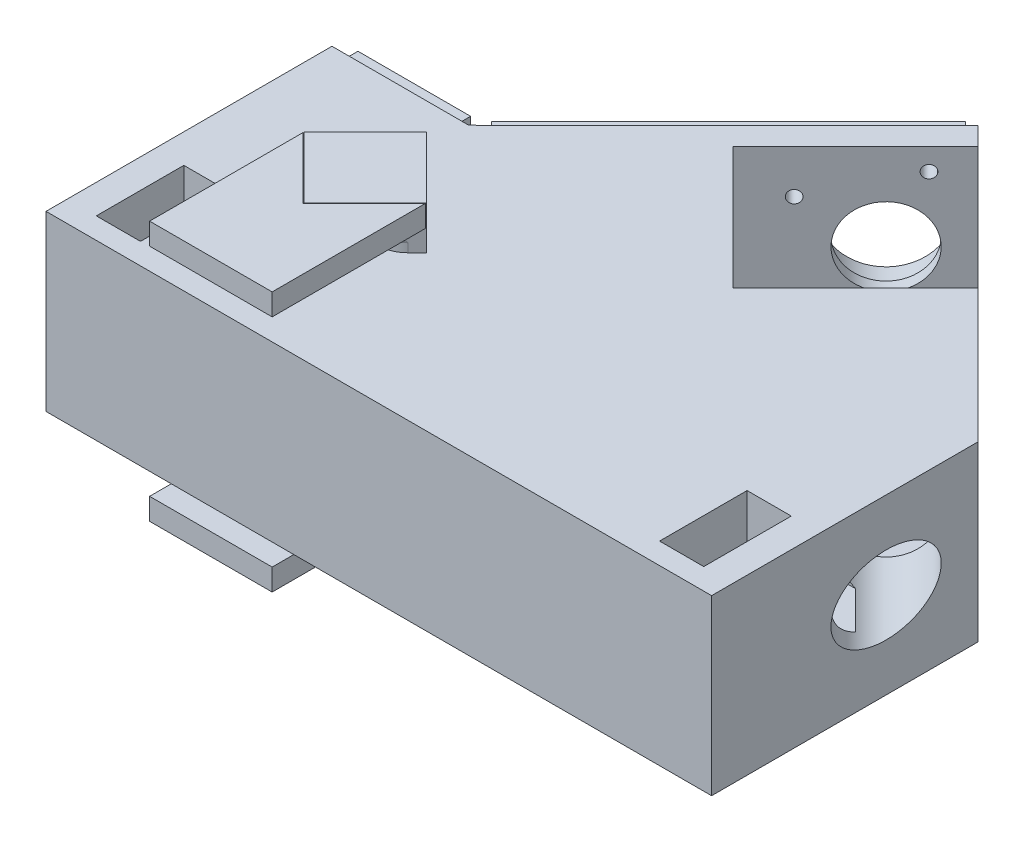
SolidWorks part; units mm, degrees
ref_plane "Спереди" through (0, 0, 0) normal (0, 0, 1) x (1, 0, 0)
ref_plane "Сверху" through (0, 0, 0) normal (0, 1, 0) x (1, 0, 0)
ref_plane "Справа" through (0, 0, 0) normal (1, 0, 0) x (0, 0, -1)
sketch "Sketch1" plane through (0, 0, 0) normal (0, 1, 0) x (1, 0, 0)
  line L0 (-79.5035, -54.4347) -> (-79.5035, -4.4347)
  line L1 (-79.5035, -54.4347) -> (60.4965, -54.4347)
  line L2 (-21.9513, 53.1175) -> (-14.8802, 46.0465)
  line L3 (-21.9513, 53.1175) -> (-46.7, 28.3688)
  line L4 (-14.8802, 46.0465) -> (-43.1645, 17.7622)
  line L5 (-43.1645, 17.7622) -> (-14.8802, -10.5221)
  line L6 (-14.8802, -10.5221) -> (13.404, 17.7622)
  line L7 (13.404, 17.7622) -> (60.4965, -29.3302)
  line L8 (60.4965, -29.3302) -> (60.4965, -54.4347)
  line L9 (-79.5035, -4.4347) -> (-46.7, 28.3688)
  dimension "D1" = 35
  dimension "D2" = 140
  dimension "D3" = 40
  dimension "D4" = 50
  dimension "D5" = 10
  dimension "D6" = 40
extrude "Boss-Extrude1" add sketch "Sketch1" along normal blind 40
sketch "Sketch3" plane through (-37.5344, 0, -37.5344) normal (-0.7071, 0, -0.7071) x (-0.7071, 0, 0.7071)
  line L0 (-22.0379, 20) -> (59.3533, 20) construction
  line L1 (-22.0379, 40) -> (-22.0379, 0) construction
  line L2 (59.3533, 40) -> (59.3533, 0) construction
  circle A0 centre (-7.0379, 20) radius 9
  dimension "D1" = 18
  dimension "D2" = 15
extrude "Cut-Extrude1" cut sketch "Sketch3" against normal through all
sketch "Sketch4" plane through (15.5831, 0, -15.5831) normal (0.7071, 0, -0.7071) x (-0.7071, 0, -0.7071)
  line L0 (3.0817, 20) -> (-63.517, 20) construction
  line L1 (3.0817, 40) -> (3.0817, 0) construction
  line L2 (-63.517, 40) -> (-63.517, 0) construction
  line L3 (-6.9183, 0) -> (-6.9183, 40) construction
  line L4 (-63.517, 0) -> (3.0817, 0) construction
  line L5 (-63.517, 40) -> (3.0817, 40) construction
  line L6 (-31.9183, 0) -> (-31.9183, 40) construction
  line L7 (-6.9183, 5) -> (-6.9183, 35)
  line L8 (-6.9183, 35) -> (-31.9183, 35)
  line L9 (-31.9183, 35) -> (-31.9183, 5)
  line L10 (-31.9183, 5) -> (-6.9183, 5)
  dimension "D1" = 10
  dimension "D2" = 25
  dimension "D3" = 5
  dimension "D4" = 5
extrude "Cut-Extrude2" cut sketch "Sketch4" against normal blind 30
sketch "Sketch5" plane through (-37.5344, 0, -37.5344) normal (-0.7071, 0, -0.7071) x (-0.7071, 0, 0.7071)
  circle A0 centre (-7.0379, 20) radius 11.1
  dimension "D1" = 22.2
extrude "Cut-Extrude3" cut sketch "Sketch5" against normal blind 7
sketch "Sketch6" plane through (4.892, 0, 4.892) normal (0.7071, 0, 0.7071) x (0.7071, 0, -0.7071)
  circle A0 centre (7.0379, 20) radius 11.1
  dimension "D1" = 22.2
extrude "Cut-Extrude4" cut sketch "Sketch6" against normal blind 7
sketch "Sketch7" plane through (0, 40, 0) normal (0, 1, 0) x (1, 0, 0)
  line L0 (44.1167, -12.9505) -> (44.1167, -54.4347)
  line L1 (60.4965, -29.3302) -> (13.404, 17.7622) construction
  line L2 (-79.5035, -54.4347) -> (60.4965, -54.4347) construction
  line L3 (44.1167, -54.4347) -> (60.4965, -54.4347)
  line L4 (60.4965, -54.4347) -> (60.4965, -29.3302)
  line L5 (60.4965, -29.3302) -> (44.1167, -12.9505)
extrude "Cut-Extrude5" cut sketch "Sketch7" against normal through all
sketch "Sketch9" plane through (-79.5035, 0, 0) normal (-1, 0, 0) x (0, 0, 1)
  line L0 (4.4347, 0) -> (54.4347, 0)
  line L1 (54.4347, 0) -> (54.4347, 40)
  line L2 (54.4347, 40) -> (4.4347, 40)
  line L3 (4.4347, 40) -> (4.4347, 0)
extrude "Boss-Extrude2" add sketch "Sketch9" along normal blind 30
sketch "Sketch11" plane through (-37.5344, 0, -37.5344) normal (-0.7071, 0, -0.7071) x (-0.7071, 0, 0.7071)
  line L0 (7.9621, 0) -> (7.9621, 40) construction
  line L1 (-22.0379, 0) -> (59.3533, 0) construction
  line L2 (-22.0379, 40) -> (59.3533, 40) construction
  circle A1 centre (7.9621, 10) radius 1.45
  circle A2 centre (7.9621, 30) radius 1.45
  circle A3 centre (-7.0379, 20) radius 11.1 construction
  point P10 (7.9621, 20)
  dimension "D1" = 20
  dimension "D4" = 2.9
  dimension "D2" = 10
  dimension "D3" = 15
extrude "Cut-Extrude8" cut sketch "Sketch11" against normal blind 20
sketch "Sketch13" plane through (0, 40, 0) normal (0, 1, 0) x (1, 0, 0)
  line L0 (-21.9513, 53.1175) -> (-57.0321, 88.7453) construction
  line L1 (-109.5035, -4.4347) -> (-109.5035, 36.2739) construction
  line L2 (-109.5035, 36.2739) -> (-57.0321, 88.7453) construction
  line L3 (-21.9513, 53.1175) -> (-79.5035, -4.4347) construction
  line L4 (-109.5035, -4.4347) -> (-79.5035, -4.4347) construction
  line L5 (-79.5035, -4.4347) -> (-21.9513, 53.1175) construction
  dimension "D1" = 50
  dimension "D2" = 74.2058
  dimension "D3" = 40.7086
  dimension "D4" = 135
  dimension "D5" = 30
  dimension "D6" = 81.3912
sketch "Sketch15" plane through (-37.5344, 0, -37.5344) normal (-0.7071, 0, -0.7071) x (-0.7071, 0, 0.7071)
  line L0 (-22.0379, 0) -> (59.3533, 40) construction
  line L1 (-22.0379, 40) -> (-22.0379, 0) construction
  line L2 (57.3533, 38) -> (-20.0379, 38)
  line L3 (57.3533, 38) -> (57.3533, 2)
  line L4 (57.3533, 2) -> (-20.0379, 2)
  line L5 (-20.0379, 38) -> (-20.0379, 2)
  line L6 (57.3533, 38) -> (-20.0379, 2) construction
  line L7 (57.3533, 2) -> (-20.0379, 38) construction
  line L8 (-22.0379, 0) -> (59.3533, 0) construction
  line L10 (59.3533, 40) -> (-22.0379, 40)
  line L11 (59.3533, 40) -> (59.3533, 0)
  line L12 (59.3533, 0) -> (-22.0379, 0)
  line L13 (-22.0379, 40) -> (-22.0379, 0)
  line L14 (59.3533, 40) -> (-22.0379, 0) construction
  line L15 (59.3533, 0) -> (-22.0379, 40) construction
  point P4 (18.6577, 20)
  point P13 (18.6577, 20)
  dimension "D1" = 2
  dimension "D2" = 2
extrude "Cut-Extrude9" cut sketch "Sketch15" against normal blind 4
sketch "Sketch16" plane through (0, 0, 4.4347) normal (0, 0, -1) x (-1, 0, 0)
  line L0 (79.5035, 0) -> (109.5035, 40) construction
  line L2 (109.5035, 40) -> (79.5035, 40)
  line L3 (109.5035, 40) -> (109.5035, 0)
  line L4 (109.5035, 0) -> (79.5035, 0)
  line L5 (79.5035, 40) -> (79.5035, 0)
  line L6 (109.5035, 40) -> (79.5035, 0) construction
  line L7 (109.5035, 0) -> (79.5035, 40) construction
  line L8 (107.5035, 38) -> (81.5035, 38)
  line L9 (107.5035, 38) -> (107.5035, 2)
  line L10 (107.5035, 2) -> (81.5035, 2)
  line L11 (81.5035, 38) -> (81.5035, 2)
  line L12 (107.5035, 38) -> (81.5035, 2) construction
  line L13 (107.5035, 2) -> (81.5035, 38) construction
  point P4 (94.5035, 20)
  point P5 (94.5035, 20)
  dimension "D1" = 2
  dimension "D2" = 2
extrude "Cut-Extrude10" cut sketch "Sketch16" against normal blind 4
sketch "Sketch17" plane through (0, 0, 0) normal (0, -1, 0) x (1, 0, 0)
  line L0 (-76.6751, 7.2631) -> (-78.0893, 8.4347)
  line L1 (-78.0893, 8.4347) -> (-79.5035, 8.4347)
  line L2 (-79.5035, 8.4347) -> (-109.5035, 8.4347) construction
  line L3 (-76.6751, 7.2631) -> (-79.5035, 4.4347)
  line L4 (-79.5035, 4.4347) -> (-79.5035, 8.4347)
extrude "Cut-Extrude11" cut sketch "Sketch17" against normal through all
sketch "Sketch18" plane through (0, 40, 0) normal (0, 1, 0) x (1, 0, 0)
  line L0 (-109.5035, -54.4347) -> (-109.5035, -74.4347)
  line L1 (-109.5035, -74.4347) -> (44.1167, -74.4347)
  line L2 (44.1167, -74.4347) -> (44.1167, -54.4347)
  line L3 (44.1167, -54.4347) -> (-109.5035, -54.4347)
  dimension "D1" = 20
extrude "Boss-Extrude3" add sketch "Sketch18" against normal up to surface (40 mm away)
sketch "Sketch10" plane through (0, 40, 0) normal (0, 1, 0) x (1, 0, 0)
  line L0 (-109.5035, -59.4347) -> (44.1167, -59.4347) construction
  line L1 (-109.5035, -74.4347) -> (-109.5035, -8.4347) construction
  line L2 (44.1167, -12.9505) -> (44.1167, -74.4347) construction
  line L4 (-102.7934, -69.5347) -> (-92.5934, -69.5347)
  line L5 (-102.7934, -69.5347) -> (-102.7934, -49.3347)
  line L6 (-102.7934, -49.3347) -> (-92.5934, -49.3347)
  line L7 (-92.5934, -69.5347) -> (-92.5934, -49.3347)
  line L8 (-102.7934, -69.5347) -> (-92.5934, -49.3347) construction
  line L9 (-102.7934, -49.3347) -> (-92.5934, -69.5347) construction
  line L10 (37.4066, -69.5347) -> (27.2066, -69.5347)
  line L11 (37.4066, -69.5347) -> (37.4066, -49.3347)
  line L12 (37.4066, -49.3347) -> (27.2066, -49.3347)
  line L13 (27.2066, -69.5347) -> (27.2066, -49.3347)
  line L14 (37.4066, -69.5347) -> (27.2066, -49.3347) construction
  line L15 (37.4066, -49.3347) -> (27.2066, -69.5347) construction
  point P6 (-97.6934, -59.4347)
  point P11 (32.3066, -59.4347)
  point P18 (-32.6934, -59.4347)
  dimension "D1" = 10.2
  dimension "D2" = 20.2
  dimension "D3" = 15
  dimension "D4" = 130
  dimension "D5" = 65
  dimension "D6" = 11.8101
extrude "Cut-Extrude7" cut sketch "Sketch10" against normal through all
sketch "Sketch19" plane through (-109.5035, 0, 0) normal (-1, 0, 0) x (0, 0, 1)
  line L0 (8.4347, 20) -> (74.4347, 20) construction
  line L1 (8.4347, 0) -> (8.4347, 40) construction
  line L2 (74.4347, 0) -> (74.4347, 40) construction
  line L4 (43.9347, 27.5) -> (28.9347, 27.5)
  line L5 (43.9347, 27.5) -> (43.9347, 12.5)
  line L6 (43.9347, 12.5) -> (28.9347, 12.5)
  line L7 (28.9347, 27.5) -> (28.9347, 12.5)
  line L8 (43.9347, 27.5) -> (28.9347, 12.5) construction
  line L9 (43.9347, 12.5) -> (28.9347, 27.5) construction
  point P6 (36.4347, 20)
  dimension "D1" = 15
  dimension "D2" = 15
  dimension "D3" = 38
extrude "Cut-Extrude12" cut sketch "Sketch19" against normal blind 150
sketch "Sketch20" plane through (-37.5344, 0, -37.5344) normal (-0.7071, 0, -0.7071) x (-0.7071, 0, 0.7071)
  line L0 (-20.0379, 5) -> (57.3533, 5) construction
  line L1 (-20.0379, 38) -> (-20.0379, 2) construction
  line L2 (57.3533, 2) -> (57.3533, 38) construction
  line L3 (-20.0379, 35) -> (57.3533, 35) construction
  line L4 (-14.0379, 5) -> (-14.0379, 35) construction
  line L5 (45.9621, 5) -> (45.9621, 35) construction
  line L7 (-22.0379, 40) -> (-22.0379, 0) construction
  circle A0 centre (45.9621, 5) radius 1.45
  circle A1 centre (45.9621, 35) radius 1.45
  circle A2 centre (-14.0379, 35) radius 1.45
  circle A3 centre (-14.0379, 5) radius 1.45
  point P8 (-20.0379, 20)
  point P17 (-14.0379, 20)
  dimension "D3" = 2.9
  dimension "D1" = 30
  dimension "D2" = 15
  dimension "D4" = 60
  dimension "D5" = 8
extrude "Cut-Extrude13" cut sketch "Sketch20" against normal blind 20
sketch "Sketch21" plane through (0, 40, 0) normal (0, 1, 0) x (1, 0, 0)
  line L0 (-43.1645, 17.7622) -> (-85.5909, -38.8063) construction
  line L1 (-85.5909, -38.8063) -> (-71.4488, -52.9485) construction
  line L2 (-71.4488, -52.9485) -> (-14.8802, -10.5221) construction
  line L3 (-14.8802, -10.5221) -> (-43.1645, 17.7622) construction
  line L4 (-78.5198, -45.8774) -> (-29.0224, 3.6201) construction
  line L5 (-85.5909, -38.8063) -> (-71.4488, -52.9485)
  line L6 (-71.4488, -52.9485) -> (-57.3066, -38.8063)
  line L7 (-57.3066, -38.8063) -> (-71.4488, -24.6642)
  line L8 (-71.4488, -24.6642) -> (-85.5909, -38.8063)
  dimension "D1" = 70
  dimension "D2" = 20
  dimension "D3" = 20
extrude "Boss-Extrude4" add sketch "Sketch21" along normal blind 10
sketch "Sketch23" plane through (0, 0, 0) normal (0, -1, 0) x (1, 0, 0)
  line L0 (-14.8802, 10.5221) -> (-71.4488, 52.9485) construction
  line L1 (-71.4488, 52.9485) -> (-85.5909, 38.8063) construction
  line L2 (-85.5909, 38.8063) -> (-43.1645, -17.7622) construction
  line L4 (-78.5198, 45.8774) -> (-29.0224, -3.6201) construction
  line L5 (-71.4488, 52.9485) -> (-85.5909, 38.8063)
  line L6 (-85.5909, 38.8063) -> (-71.4488, 24.6642)
  line L7 (-71.4488, 24.6642) -> (-57.3066, 38.8063)
  line L8 (-57.3066, 38.8063) -> (-71.4488, 52.9485)
  line L10 (-43.1645, -17.7622) -> (-14.8802, 10.5221) construction
  point P3 (-64.3777, 31.7353)
  dimension "D1" = 70
  dimension "D2" = 20
  dimension "D3" = 20
extrude "Boss-Extrude5" add sketch "Sketch23" along normal blind 10
sketch "Sketch24" plane through (-23.3923, 0, -23.3923) normal (-0.7071, 0, -0.7071) x (-0.7071, 0, 0.7071)
  line L0 (87.9621, 0) -> (87.9621, -5)
  line L1 (87.9621, -10) -> (87.9621, 0) construction
  line L2 (87.9621, -5) -> (77.9621, -5)
  line L3 (77.9621, -5) -> (77.9621, 0)
  line L4 (87.9621, 0) -> (67.9621, 0) construction
  line L5 (77.9621, 0) -> (87.9621, 0)
  line L6 (87.9621, 40) -> (77.9621, 40)
  line L7 (67.9621, 40) -> (87.9621, 40) construction
  line L8 (77.9621, 40) -> (77.9621, 45)
  line L9 (77.9621, 45) -> (87.9621, 45)
  line L10 (87.9621, 50) -> (87.9621, 40) construction
  line L11 (87.9621, 45) -> (87.9621, 40)
  dimension "D1" = 10
  dimension "D2" = 5
extrude "Cut-Extrude14" cut sketch "Sketch24" against normal up to surface (20 mm away)
fillet "Fillet1" radius 7 4 edges at (-64.3777, 42.5, 45.8774) (-78.5198, 42.5, 31.7353) (-64.3777, -2.5, 45.8774) (-78.5198, -2.5, 31.7353)
sketch "Sketch26" plane through (0, -10, 0) normal (0, -1, 0) x (1, 0, 0)
  line L0 (-57.3066, 79.0063) -> (-57.3066, 39.0063)
  line L1 (-57.3066, 39.0063) -> (-71.4488, 53.1485)
  line L2 (-85.5909, 79.0063) -> (-57.3066, 79.0063)
  line L3 (-71.4488, 53.1485) -> (-85.5909, 39.0063)
  line L4 (-85.5909, 39.0063) -> (-85.5909, 79.0063)
  line L5 (-57.3066, 38.8063) -> (-85.5909, 38.8063) construction
  line L6 (-71.4488, 24.6642) -> (-71.4488, 79.0063) construction
  point P12 (-71.4488, 79.0063)
  dimension "D1" = 0.2
  dimension "D2" = 40
extrude "Boss-Extrude6" add sketch "Sketch26" against normal blind 5 separate body
fillet "Fillet2" radius 3 11 edges at (-64.3777, -5, 42.9779) (-71.4488, -5, 38.8063) (-64.3777, 45, 42.9779) (-71.4488, 45, 38.8063) (-75.6203, 45, 31.7353) (-79.5805, 45, 32.7959) (-78.5198, 45, 45.8774) (-65.4384, 45, 46.9381) (-75.6203, -5, 31.7353) (-65.4384, -5, 46.9381) (-79.5805, -5, 32.7959)
sketch "Sketch28" plane through (0, 50, 0) normal (0, 1, 0) x (1, 0, 0)
  line L0 (-57.3066, -38.8063) -> (-85.5909, -38.8063) construction
  line L1 (-71.4488, -24.6642) -> (-71.4488, -77.8526) construction
  line L2 (-85.5909, -39.0063) -> (-71.4488, -53.1485)
  line L3 (-71.4488, -53.1485) -> (-57.3066, -39.0063)
  line L4 (-57.3066, -39.0063) -> (-57.3066, -79.0063)
  line L5 (-57.3066, -79.0063) -> (-85.5909, -79.0063)
  line L6 (-85.5909, -79.0063) -> (-85.5909, -39.0063)
  dimension "D1" = 0.2
  dimension "D2" = 40
extrude "Boss-Extrude7" add sketch "Sketch28" against normal blind 5 separate body
sketch "Sketch30" plane through (-109.5035, 0, 0) normal (-1, 0, 0) x (0, 0, 1)
  line L0 (74.4347, 20) -> (86.6307, 20) construction
  line L1 (74.4347, 0) -> (74.4347, 40) construction
  line L3 (86.6307, 89.9728) -> (74.4347, 89.9728)
  line L4 (86.6307, 89.9728) -> (86.6307, -49.9728)
  line L5 (86.6307, -49.9728) -> (74.4347, -49.9728)
  line L6 (74.4347, 89.9728) -> (74.4347, -49.9728)
  line L7 (86.6307, 89.9728) -> (74.4347, -49.9728) construction
  line L8 (86.6307, -49.9728) -> (74.4347, 89.9728) construction
  point P4 (80.5327, 20)
extrude "Cut-Extrude16" cut sketch "Sketch30" against normal through all
sketch "Sketch31" plane through (-37.5344, 0, -37.5344) normal (-0.7071, 0, -0.7071) x (-0.7071, 0, 0.7071)
  line L0 (7.9621, 10) -> (7.9621, 30) construction
  line L1 (7.9621, 20) -> (-7.0379, 20) construction
  dimension "D1" = 15
  dimension "D2" = 20
